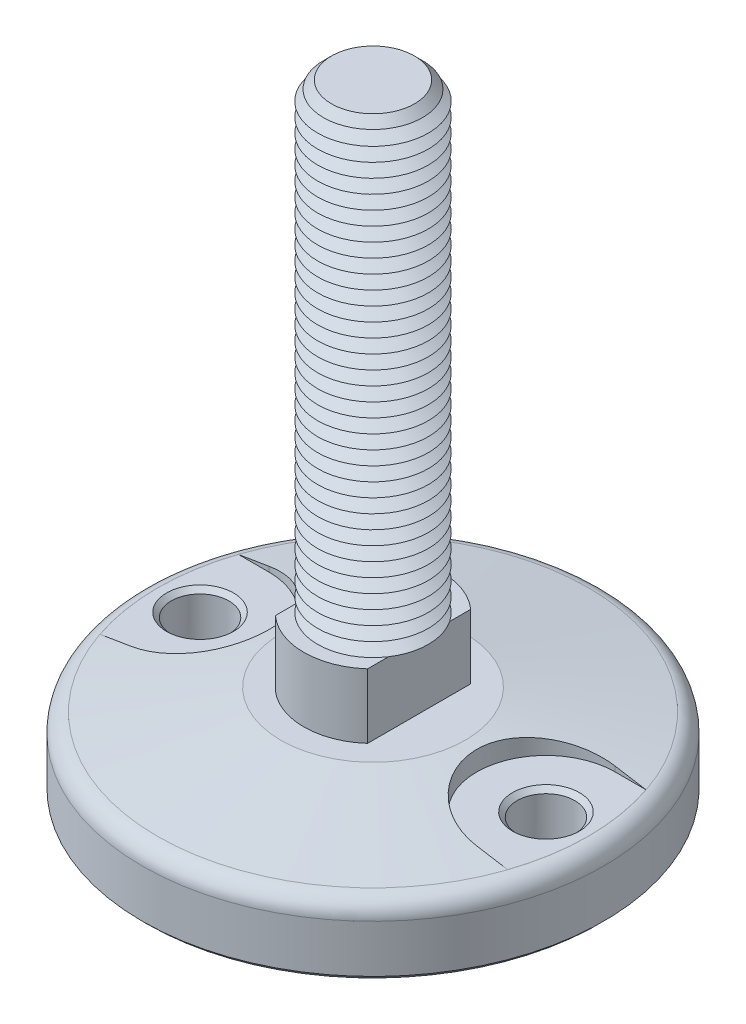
SolidWorks part; units mm, degrees
ref_plane "Front Plane" through (0, 0, 0) normal (0, 0, 1) x (1, 0, 0)
ref_plane "Top Plane" through (0, 0, 0) normal (0, 1, 0) x (1, 0, 0)
ref_plane "Right Plane" through (0, 0, 0) normal (1, 0, 0) x (0, 0, -1)
sketch "Sketch1" plane through (0, 0, 0) normal (1, 0, 0) x (0, 0, -1)
  line L0 (0, 61.3389) -> (0, -58.404) construction
sketch "Sketch2" plane through (0, 0, 0) normal (1, 0, 0) x (0, 0, -1)
  line L0 (0, 0) -> (-20, 0)
  line L1 (-20, 0) -> (-50, -5.2898)
  line L2 (-50, -5.2898) -> (-50, -20)
  line L3 (-50, -20) -> (0, -20)
  line L4 (0, 61.3389) -> (0, -58.404) construction
  line L5 (0, -20) -> (0, 0)
  dimension "D1" = 20
  dimension "D2" = 50
  dimension "D3" = 20
  dimension "D4" = 10
revolve "Revolve1" add sketch "Sketch2" angle 360 about L0
fillet "Fillet1" radius 4 1 edges at (0, -5.2898, 50)
sketch "Sketch3" plane through (0, 0, 0) normal (0, 1, 0) x (1, 0, 0)
  circle A0 centre (0, 0) radius 15
  dimension "D1" = 30
extrude "Boss-Extrude1" add sketch "Sketch3" along normal blind 14
sketch "Sketch4" plane through (0, 14, 0) normal (0, 1, 0) x (1, 0, 0)
  line L0 (-10, 11.1803) -> (-10, -11.1803)
  line L2 (10, -11.1803) -> (10, 11.1803)
  arc A0 (-10, 11.1803) -> (-10, -11.1803) centre (0, 0) ccw
  circle A1 centre (0, 0) radius 15 construction
  arc A2 (10, -11.1803) -> (10, 11.1803) centre (0, 0) ccw
  dimension "D1" = 20
extrude "Cut-Extrude1" cut sketch "Sketch4" against normal blind 14
sketch "Sketch5" plane through (0, 14, 0) normal (0, 1, 0) x (1, 0, 0)
  circle A0 centre (0, 0) radius 12
  dimension "D1" = 24
extrude "Boss-Extrude2" add sketch "Sketch5" along normal blind 100
chamfer "Chamfer1" distance 3 angle 45 1 edges at (0, 114, 12)
sketch "Sketch6" plane through (0, 0, 0) normal (1, 0, 0) x (0, 0, -1)
  line L0 (-12, 14) -> (-9.4019, 15.5)
  line L1 (-9.4019, 15.5) -> (-12, 17)
  line L2 (-12, 111) -> (-12, 14) construction
  line L3 (-12, 17) -> (-12, 14)
  dimension "D1" = 3
revolve "Cut-Revolve1" cut sketch "Sketch6" angle 360 about L0
pattern_linear "LPattern1" count 33 spacing 3 along (0, 1, 0) of "Cut-Revolve1"
sketch "Sketch8" plane through (0, 0, 0) normal (0, 1, 0) x (1, 0, 0)
  line L0 (-37.5, 15) -> (-44.2197, 15)
  line L1 (-37.5, -15) -> (-44.2197, -15)
  arc A1 (-44.2197, 15) -> (-44.2197, -15) centre (0, 0) ccw
  circle A2 centre (0, 0) radius 46.6946 construction
  arc A3 (-37.5, -15) -> (-37.5, 15) centre (-37.5, 0) ccw
  point P3 (-37.5, 0)
  point P11 (0, 0)
  dimension "D1" = 37.5
  dimension "D2" = 30
extrude "Cut-Extrude4" cut sketch "Sketch8" against normal blind 4.7
sketch "Sketch10" plane through (0, -4.7, 0) normal (0, 1, 0) x (1, 0, 0)
  circle A0 centre (-37.5, 0) radius 6.25
  dimension "D1" = 12.5
extrude "Cut-Extrude5" cut sketch "Sketch10" against normal up to surface (15.3 mm away)
chamfer "Chamfer2" distance 1 angle 45 2 edges at (-37.5, -20, -6.25) (-37.5, -4.7, 6.25)
mirror "Mirror1" about plane through (0, 0, 0) normal (1, 0, 0) of "Chamfer2", "Cut-Extrude5", "Cut-Extrude4"
chamfer "Chamfer3" distance 1 angle 45 1 edges at (0, -20, 50)
